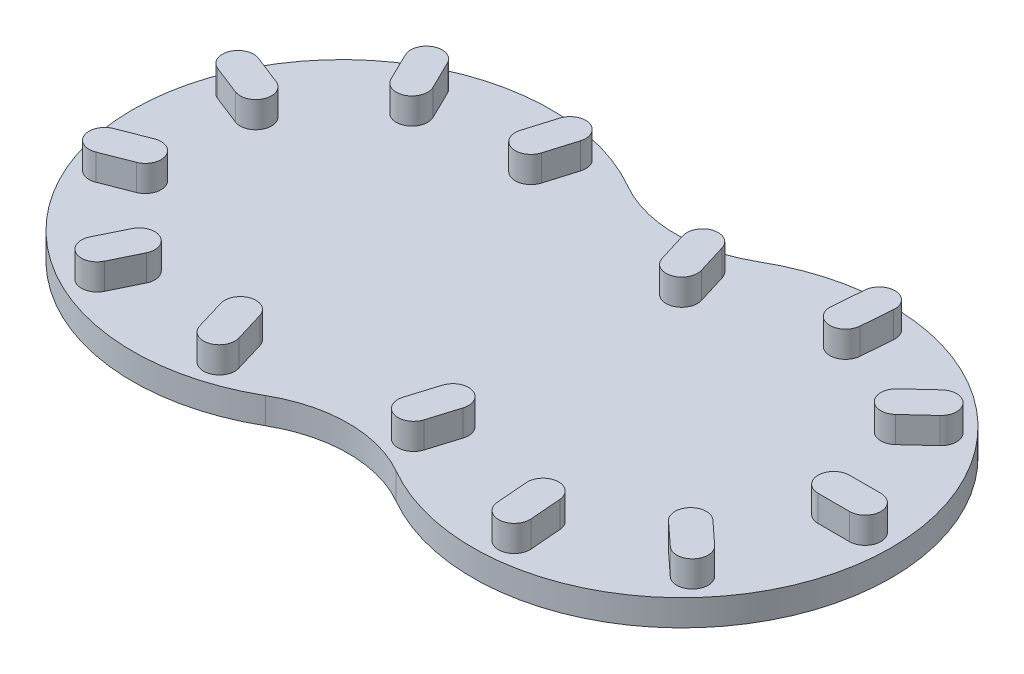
SolidWorks part; units mm, degrees
ref_plane "Front Plane" through (0, 0, 0) normal (0, 0, 1) x (1, 0, 0)
ref_plane "Top Plane" through (0, 0, 0) normal (0, 1, 0) x (1, 0, 0)
ref_plane "Right Plane" through (0, 0, 0) normal (1, 0, 0) x (0, 0, -1)
sketch "Sketch1" plane through (0, 0, 0) normal (0, 1, 0) x (1, 0, 0)
  arc A0 (20, 34.641) -> (20, -34.641) centre (0, 0) ccw
  arc A1 (20, 34.641) -> (45, 34.641) centre (32.5, 56.2917) ccw
  arc A2 (45, 34.641) -> (45, -34.641) centre (65, 0) cw
  arc A3 (45, -34.641) -> (20, -34.641) centre (32.5, -56.2917) ccw
  dimension "D1" = 40
  dimension "D2" = 25
  dimension "D3" = 65
extrude "Extrude1" add sketch "Sketch1" along normal blind 5
sketch "Sketch3" plane through (0, 5, 0) normal (0, 1, 0) x (-1, 0, 0)
  line L0 (-105, 0) -> (-100, 0) construction
  line L1 (-94, 3) -> (-100, 3)
  line L2 (-100, -3) -> (-94, -3)
  arc A0 (-45, 34.641) -> (-45, -34.641) centre (-65, 0) ccw construction
  arc A1 (-100, 3) -> (-100, -3) centre (-100, 0) ccw
  arc A2 (-94, -3) -> (-94, 3) centre (-94, 0) ccw
  dimension "D1" = 3
  dimension "D2" = 6
  dimension "D3" = 5
extrude "Extrude4" add sketch "Sketch3" along normal blind 5
sketch "Sketch4" plane through (0, 5, 0) normal (0, 1, 0) x (-1, 0, 0)
  arc A4 (-20, -34.641) -> (-45, -34.641) centre (-32.5, -56.2917) ccw
  arc A5 (-20, -34.641) -> (-20, 34.641) centre (0, 0) ccw
  arc A6 (-45, 34.641) -> (-20, 34.641) centre (-32.5, 56.2917) ccw
  arc A7 (-45, 34.641) -> (-45, -34.641) centre (-65, 0) ccw
  arc A8 (-20, -34.641) -> (-45, -34.641) centre (-32.5, -56.2917) ccw
  arc A9 (-20, -34.641) -> (-20, 34.641) centre (0, 0) ccw
  arc A10 (-45, 34.641) -> (-20, 34.641) centre (-32.5, 56.2917) ccw
  arc A11 (-45, 34.641) -> (-45, -34.641) centre (-65, 0) ccw
  dimension "D1" = 0
pattern_curve "CrvPattern1" of "Extrude4" parameters "D1"=13, "D3"=9, "D2"=1, "D4"=11
